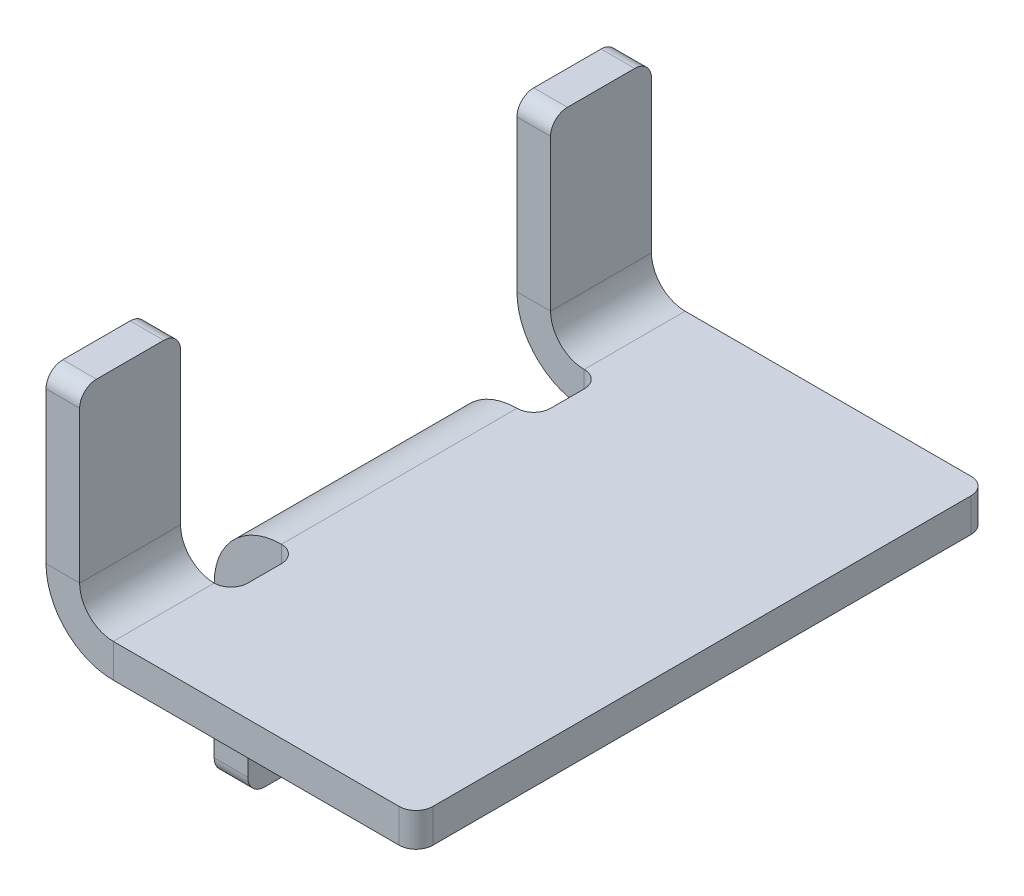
SolidWorks part; units mm, degrees
ref_plane "Face" through (0, 0, 0) normal (0, 0, 1) x (1, 0, 0)
ref_plane "Dessus" through (0, 0, 0) normal (0, 1, 0) x (1, 0, 0)
ref_plane "Droite" through (0, 0, 0) normal (1, 0, 0) x (0, 0, -1)
sketch "Esquisse1" plane through (0, 0, 0) normal (0, 0, 1) x (1, 0, 0)
  line L0 (0, 0) -> (10, 0)
  dimension "D1" = 10
extrude "Tôle de base" add sketch "Esquisse1" along normal mid plane 17 thin
sketch "Esquisse2" plane through (0, 0, 0) normal (0, 1, 0) x (-1, 0, 0)
  line L0 (0, 3.5) -> (-1.5, 3.5)
  line L1 (0, 8.5) -> (0, -8.5) construction
  line L2 (0, 8.5) -> (-10, 8.5) construction
  dimension "D1" = 5
  dimension "D2" = 1.5
extrude "Saignée" cut sketch "Esquisse2" against normal through all thin
mirror "Symétrie1" about plane through (0, 0, 0) normal (0, 0, 1)
sheet metal parameters "Tôlerie 1" parameters "D1"=1
flatten bends "Dépliage 1" parameters "D1"=0
sketch "Esquisse-Angle1" plane through (0, 0, 0) normal (0, 1, 0) x (-1, 0, 0)
process bends "Pliage 1" parameters "D1"=0
sketch "Esquisse-Plate1" plane through (0, 0, 0) normal (0, 1, 0) x (-1, 0, 0)
edge flange "Tôle pliée sur arête1" sketch "Esquisse11" bend radius 1 parameters "D6"=10
sketch "Esquisse11" plane through (0, 0, 0) normal (-1, 0, 0) x (0, 0, 1)
  line L2 (5.5, 0) -> (5.5, 6)
  line L3 (5.5, 6) -> (8.5, 6)
  line L4 (8.5, 6) -> (8.5, 0)
  line L5 (8.5, 0) -> (5.5, 0) construction
  line L6 (8.5, 0) -> (5.5, 0)
bend "Pli d'arête1" bend radius 1 bend angle 90 parameters "D5"=1
edge flange "Tôle pliée sur arête4" sketch "Esquisse19" bend radius 1 parameters "D6"=10
sketch "Esquisse19" plane through (0, -1, 0) normal (-1, 0, 0) x (0, 0, -1)
  line L2 (-3.5, 0) -> (-3.5, 6)
  line L3 (-3.5, 6) -> (3.5, 6)
  line L4 (3.5, 6) -> (3.5, 0)
  line L5 (-3.5, 0) -> (3.5, 0) construction
  line L6 (-3.5, 0) -> (3.5, 0)
bend "Pli d'arête2" bend radius 1 bend angle 90 parameters "D5"=2
edge flange "Tôle pliée sur arête5" sketch "Esquisse22" bend radius 1 parameters "D6"=10
sketch "Esquisse22" plane through (0, 0, 0) normal (-1, 0, 0) x (0, 0, 1)
  line L0 (-5.5, 0) -> (-8.5, 0) construction
  line L1 (-5.5, 0) -> (-8.5, 0)
  line L2 (-8.5, 0) -> (-8.5, 6)
  line L3 (-8.5, 6) -> (-5.5, 6)
  line L4 (-5.5, 6) -> (-5.5, 0)
bend "Pli d'arête3" bend radius 1 bend angle 90 parameters "D5"=3
fillet "Congé1" radius 0.5
flat pattern "Etat déplié1"
sketch "Lignes de pliage1" plane through (0, 0, 0) normal (0, 1, 0) x (-1, 0, 0)
  line L0 (0.1781, -5.5) -> (0.1781, -8.5) construction
  line L1 (0.1781, 3.5) -> (0.1781, -3.5) construction
  line L2 (0.1781, 8.5) -> (0.1781, 5.5) construction
bend of the flat pattern "Dépliage-<Pli d'arête1>1"
bend of the flat pattern "Dépliage-<Pli d'arête2>1"
bend of the flat pattern "Dépliage-<Pli d'arête3>1"
